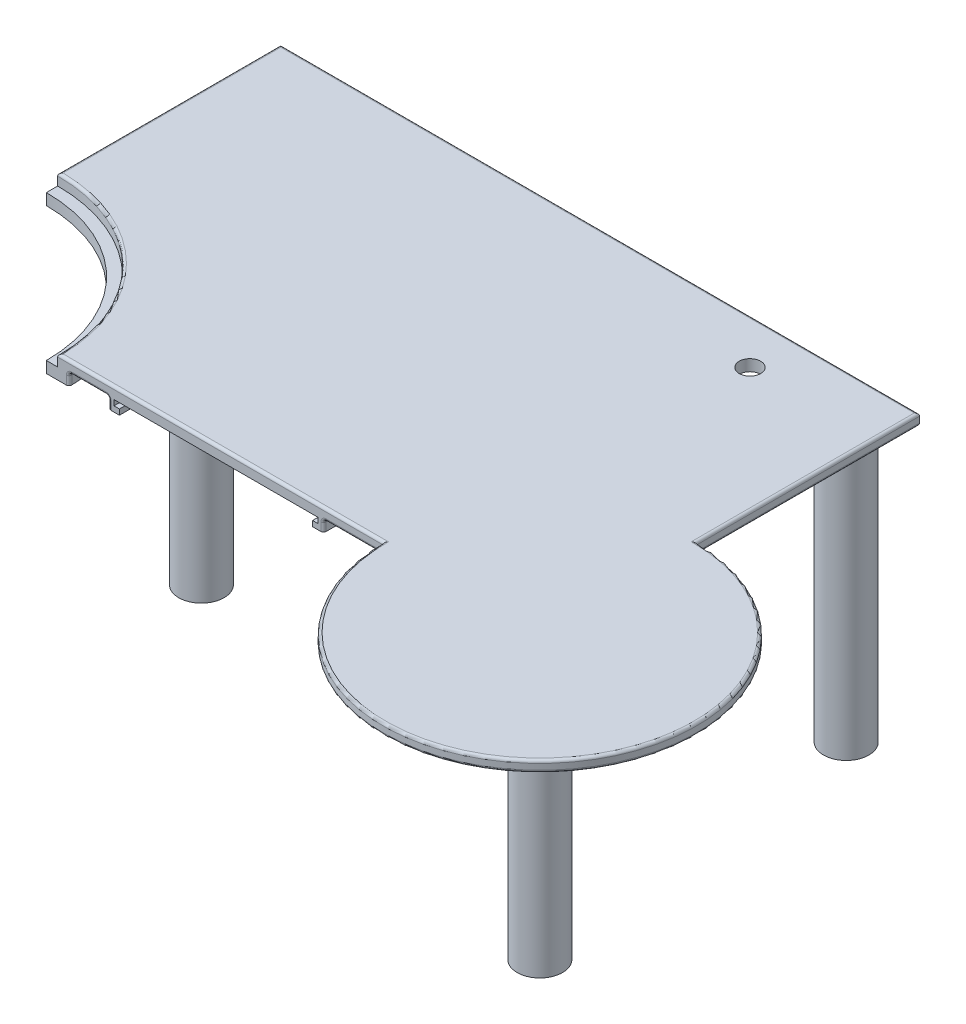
SolidWorks part; units mm, degrees
ref_plane "Front Plane" through (0, 0, 0) normal (0, 0, 1) x (1, 0, 0)
ref_plane "Top Plane" through (0, 0, 0) normal (0, 1, 0) x (1, 0, 0)
ref_plane "Right Plane" through (0, 0, 0) normal (1, 0, 0) x (0, 0, -1)
sketch "Sketch1" plane through (0, 0, 0) normal (0, 1, 0) x (1, 0, 0)
  line L0 (-52.8073, 11.2107) -> (7.9524, 11.2107)
  line L1 (7.9524, 11.2107) -> (-52.8073, 11.2107)
  line L2 (-82.0789, 82.1332) -> (37.224, 82.1332)
  line L3 (-82.0789, 82.1332) -> (-82.0789, 40.4823)
  line L6 (37.224, 82.1332) -> (37.224, 40.4823)
  arc A0 (7.9524, 11.2107) -> (37.224, 40.4823) centre (37.224, 11.2107) ccw
  arc A1 (-52.8073, 11.2107) -> (-82.0789, 40.4823) centre (-82.0789, 11.2107) ccw
extrude "Boss-Extrude1" add sketch "Sketch1" along normal blind 2.1158 contours A1 L0 A0 L6 L2 L3
sketch "Sketch2" plane through (0, 0, 0) normal (0, -1, 0) x (1, 0, 0)
  line L0 (-82.0789, -40.4823) -> (-82.0789, -38.3665)
  line L1 (-82.0789, -40.4823) -> (-82.0789, -42.5982)
  line L2 (-82.0789, -82.1332) -> (-82.0789, -40.4823) construction
  line L3 (-52.8073, -11.2107) -> (-50.6914, -11.2107)
  line L4 (-52.8073, -11.2107) -> (-54.9231, -11.2107)
  arc A0 (-82.0789, -38.3665) -> (-54.9231, -11.2107) centre (-82.0789, -11.2107) ccw
  arc A1 (-82.0789, -42.5982) -> (-50.6914, -11.2107) centre (-82.0789, -11.2107) ccw
extrude "Boss-Extrude2" add sketch "Sketch2" along normal blind 2.1158
sketch "Sketch3" plane through (0, 0, -11.2107) normal (0, 0, 1) x (1, 0, 0)
  line L0 (-4.191, 0) -> (-4.191, -1.016)
  line L1 (-50.6914, 0) -> (7.9524, 0) construction
  line L2 (-4.191, -1.016) -> (-5.207, -1.016)
  line L3 (-5.207, -1.016) -> (-5.207, -2.032)
  line L4 (-4.191, 0) -> (-3.175, 0)
  line L5 (-3.175, 0) -> (-3.175, -2.032)
  line L6 (-3.175, -2.032) -> (-5.207, -2.032)
  line L7 (-3.175, 0) -> (-4.191, 0)
  line L8 (-4.191, 0) -> (-42.291, 0)
  line L10 (-43.307, 0) -> (-43.307, -2.032)
  line L11 (-41.275, -1.016) -> (-41.275, -2.032)
  line L12 (-42.291, -1.016) -> (-41.275, -1.016)
  line L13 (-42.291, 0) -> (-42.291, -1.016)
  line L14 (-42.291, 0) -> (-43.307, 0)
  line L15 (-43.307, -2.032) -> (-41.275, -2.032)
extrude "Boss-Extrude3" add sketch "Sketch3" against normal blind 25.4 contours L10 L15 L11 L12 L13 M6 | L6 L5 L0 L2 L3 M6
sketch "Sketch4" plane through (-43.307, 0, 0) normal (-1, 0, 0) x (0, 0, 1)
  line L1 (-36.6107, -2.032) -> (-37.8029, -2.032)
  line L2 (-36.6107, -2.032) -> (-36.6107, 0)
  line L3 (-36.6107, 0) -> (-37.8029, 0)
  line L4 (-37.8029, -2.032) -> (-37.8029, 0)
extrude "Boss-Extrude4" add sketch "Sketch4" against normal up to surface (40.132 mm away)
sketch "Sketch6" plane through (0, 0, -36.6107) normal (0, 0, 1) x (1, 0, 0)
  line L0 (-5.207, -2.032) -> (-41.275, -2.032) construction
  circle A0 centre (-12.762, -2.032) radius 1.016
extrude "Cut-Extrude1" cut sketch "Sketch6" against normal blind 39.624
sketch "Sketch7" plane through (0, 0, 0) normal (0, -1, 0) x (1, 0, 0)
  circle A0 centre (37.224, -11.2107) radius 4.2316
  circle A1 centre (30.6552, -74.9888) radius 4.2316
  circle A2 centre (-75.7521, -75.6928) radius 4.2316
  circle A3 centre (-54.9864, -40.2343) radius 4.2316
extrude "Boss-Extrude5" add sketch "Sketch7" along normal blind 50.8
fillet "Fillet1" radius 0.508 24 edges at (-3.175, -1.016, -11.2107) (-43.307, -1.016, -11.2107) (-54.9864, 0, -36.0026) (30.6552, 0, -70.7571) (-3.175, 0, -24.5068) (57.9222, 0, 9.4875) (37.224, 0, -61.3078) (-22.4274, 0, -82.1332) (-43.307, 0, -24.5068) (-23.241, 0, -37.8029) (37.224, 0, -6.979) (-75.7521, 0, -71.4611) (-82.0789, 2.1158, -61.3078) (-22.4274, 2.1158, -82.1332) (37.224, 2.1158, -61.3078) (57.9222, 2.1158, 9.4875) (-22.4274, 2.1158, -11.2107) (-61.3807, 2.1158, -31.9089)
sketch "Sketch8" plane through (0, 2.1158, 0) normal (0, 1, 0) x (-1, 0, 0)
  circle A0 centre (-14.004, -73.6698) radius 2.0031
extrude "Cut-Extrude3" cut sketch "Sketch8" against normal blind 6.858
